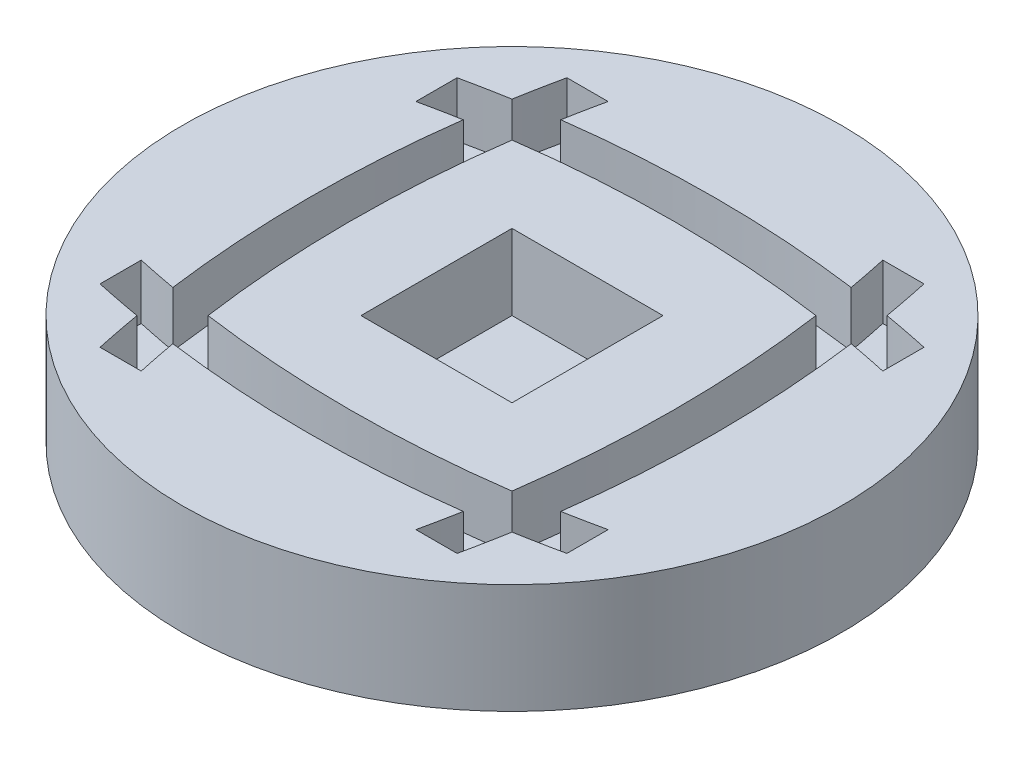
SolidWorks part; units mm, degrees
ref_plane "Front Plane" through (0, 0, 0) normal (0, 0, 1) x (1, 0, 0)
ref_plane "Top Plane" through (0, 0, 0) normal (0, 1, 0) x (1, 0, 0)
ref_plane "Right Plane" through (0, 0, 0) normal (1, 0, 0) x (0, 0, -1)
sketch "Sketch1" plane through (0, 0, 0) normal (0, 1, 0) x (1, 0, 0)
  circle A0 centre (0, 0) radius 24
  dimension "D1" = 48
extrude "Boss-Extrude1" add sketch "Sketch1" along normal blind 8
sketch "Sketch3" plane through (0, 8, 0) normal (0, 1, 0) x (1, 0, 0)
  line L0 (-5.5, 5.5) -> (5.5, 5.5)
  line L1 (5.5, 5.5) -> (5.5, -5.5)
  line L2 (5.5, -5.5) -> (-5.5, -5.5)
  line L3 (-5.5, -5.5) -> (-5.5, 5.5)
  dimension "D1" = 11
  dimension "D2" = 5.5
  dimension "D3" = 11
  dimension "D4" = 5.5
extrude "Cut-Extrude2" cut sketch "Sketch3" against normal blind 5.5
sketch "Sketch10" plane through (0, 8, 0) normal (0, 1, 0) x (1, 0, 0)
  line L1 (-17, 13) -> (-17, 10)
  line L3 (17, 10) -> (17, 13)
  line L4 (10, -17) -> (13, -17)
  line L5 (13, 17) -> (10, 17)
  line L7 (-17, -10) -> (-17, -13)
  line L8 (17, -13) -> (17, -10)
  line L10 (-10, 17) -> (-13, 17)
  line L11 (-13, -17) -> (-10, -17)
  arc A0 (-17, 13) -> (-13.6534, 13.6534) centre (0, -65.1729) cw
  arc A1 (-17, 10) -> (-14.125, 10.5759) centre (0, -67.4053) cw
  arc A2 (10, 17) -> (10.5759, 14.125) centre (-67.4053, 0) cw
  arc A3 (13, 17) -> (13.6534, 13.6534) centre (-65.1729, 0) cw
  arc A4 (17, -10) -> (14.125, -10.5759) centre (0, 67.4053) cw
  arc A5 (17, -13) -> (13.6534, -13.6534) centre (0, 65.1729) cw
  arc A6 (-10, -17) -> (-10.5759, -14.125) centre (67.4053, 0) cw
  arc A7 (-13, -17) -> (-13.6534, -13.6534) centre (65.1729, 0) cw
  arc A8 (-10.5759, 14.125) -> (-10, 17) centre (67.4053, 0) cw
  arc A9 (-13.6534, 13.6534) -> (-13, 17) centre (65.1729, 0) cw
  arc A10 (-11.0681, 11.0681) -> (11.0681, 11.0681) centre (0, -67.4053) cw
  arc A11 (-10.5759, 14.125) -> (10.5759, 14.125) centre (0, -65.1729) cw
  arc A12 (13.6534, 13.6534) -> (17, 13) centre (0, -65.1729) cw
  arc A13 (14.125, 10.5759) -> (17, 10) centre (0, -67.4053) cw
  arc A14 (11.0681, 11.0681) -> (11.0681, -11.0681) centre (-67.4053, 0) cw
  arc A15 (14.125, 10.5759) -> (14.125, -10.5759) centre (-65.1729, 0) cw
  arc A16 (13.6534, -13.6534) -> (13, -17) centre (-65.1729, 0) cw
  arc A17 (10.5759, -14.125) -> (10, -17) centre (-67.4053, 0) cw
  arc A18 (11.0681, -11.0681) -> (-11.0681, -11.0681) centre (0, 67.4053) cw
  arc A19 (10.5759, -14.125) -> (-10.5759, -14.125) centre (0, 65.1729) cw
  arc A20 (-13.6534, -13.6534) -> (-17, -13) centre (0, 65.1729) cw
  arc A21 (-14.125, -10.5759) -> (-14.125, 10.5759) centre (65.1729, 0) cw
  arc A22 (-14.125, -10.5759) -> (-17, -10) centre (0, 67.4053) cw
  arc A23 (-11.0681, -11.0681) -> (-11.0681, 11.0681) centre (67.4053, 0) cw
  point P36 (0, 0)
extrude "Cut-Extrude6" cut sketch "Sketch10" against normal blind 4
equation "\"D2@Sketch10\"=\"D1@Sketch10\"/2"
